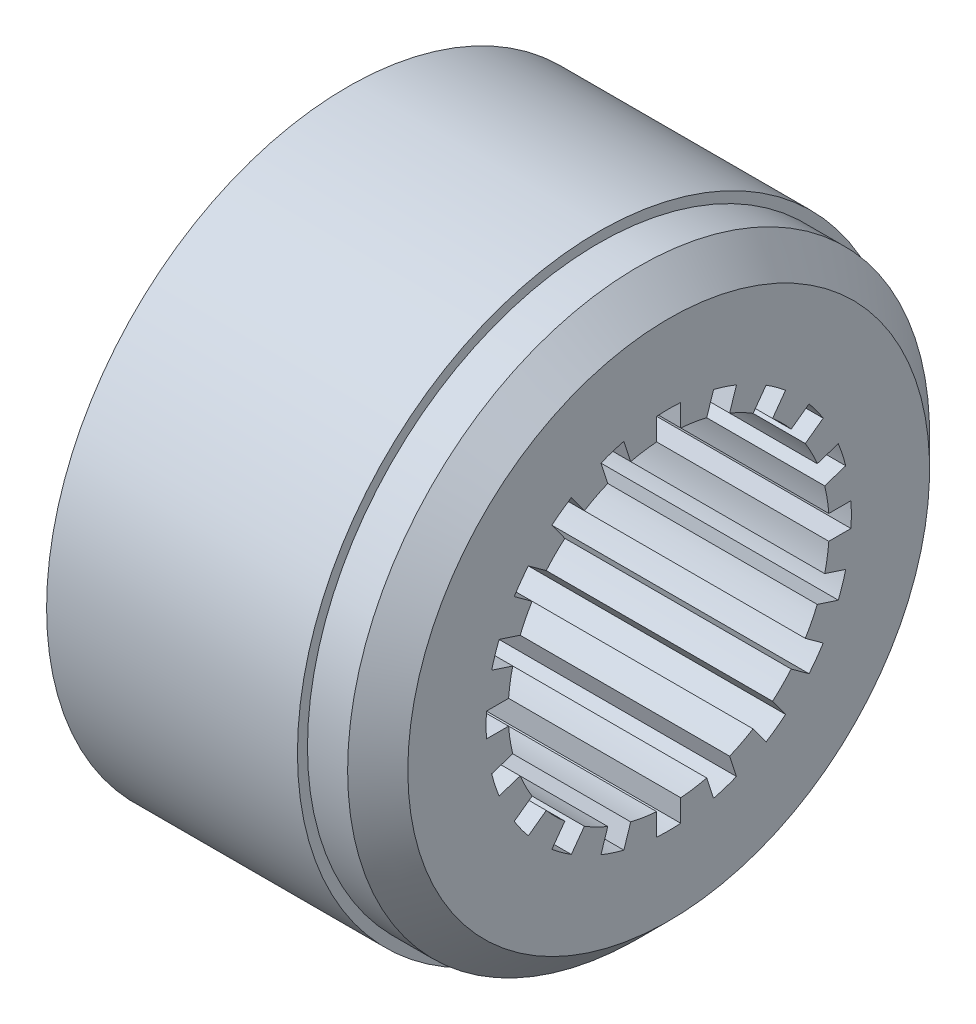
SolidWorks part; units mm, degrees
ref_plane "Face" through (0, 0, 0) normal (0, 0, 1) x (1, 0, 0)
ref_plane "Dessus" through (0, 0, 0) normal (0, 1, 0) x (1, 0, 0)
ref_plane "Droite" through (0, 0, 0) normal (1, 0, 0) x (0, 0, -1)
sketch "Esquisse1" plane through (0, 0, 0) normal (0, 0, 1) x (1, 0, 0)
  line L0 (0, 0) -> (57.3323, 0) construction
  line L1 (3.5, 40) -> (83.5, 40)
  line L2 (83.5, 40) -> (83.5, 65)
  line L3 (76, 72.5) -> (66, 72.5)
  line L4 (66, 72.5) -> (66, 75)
  line L5 (66, 75) -> (3.5, 75)
  line L6 (3.5, 75) -> (3.5, 40)
  line L7 (83.5, 65) -> (76, 72.5)
  point P6 (83.5, 72.5)
  dimension "D1" = 80
  dimension "D2" = 150
  dimension "D3" = 145
  dimension "D4" = 80
  dimension "D5" = 17.5
  dimension "D6" = 7.5
  dimension "D7" = 45
revolve "Révolution1" add sketch "Esquisse1" angle 360 about L0
sketch "Esquisse2" plane through (3.5, 0, 0) normal (-1, 0, 0) x (0, 0, 1)
  line L0 (0, 0) -> (0, 128.4384) construction
hole_wizard "Diamètre du perçage Ø16.5 (16.5)1" positions "Esquisse4" profile "Esquisse3" hole size "Ø16.5" standard "ISO"
sketch "Esquisse4" plane through (3.5, 0, 0) normal (-1, 0, 0) x (0, 0, 1)
  line L0 (0, 0) -> (0, 128.4384) construction
  circle A0 centre (0, 0) radius 40 construction
  point P0 (0, 62.5)
  dimension "D1" = 62.5
sketch "Esquisse3" plane through (3.5, 62.5, 0) normal (0, 1, 0) x (0, 0, 1)
  line L0 (0, 0) -> (0, 18.9571)
  line L1 (0, 18.9571) -> (8.25, 14)
  line L2 (8.25, 14) -> (8.25, 0)
  line L5 (8.25, 0) -> (0, 0)
  line L10 (0, 18.9571) -> (-8.25, 14) construction
  line L11 (0, -6.35) -> (0, 107.95) construction
  dimension "Diamètre du perçage" = 16.5
  dimension "Profondeur du perçage" = 14
  dimension "Angle de pointe" = 118
sketch "Esquisse5" plane through (3.5, 0, 0) normal (-1, 0, 0) x (0, 0, 1)
  line L0 (0, 0) -> (0, 128.4384) construction
  line L1 (11.1765, 44.106) -> (8.334, 35.3577)
  line L2 (-3, 45.401) -> (-3, 36.2026)
  line L3 (-3, 36.2026) -> (3, 36.2026)
  line L4 (3, 45.401) -> (3, 36.2026)
  line L5 (8.334, 35.3577) -> (14.0404, 33.5036)
  line L6 (16.8828, 42.2519) -> (14.0404, 33.5036)
  line L7 (24.259, 38.4935) -> (18.8523, 31.0518)
  line L8 (18.8523, 31.0518) -> (23.7064, 27.5251)
  line L9 (29.1131, 34.9668) -> (23.7064, 27.5251)
  line L10 (34.9668, 29.1131) -> (27.5251, 23.7064)
  line L11 (27.5251, 23.7064) -> (31.0518, 18.8523)
  line L12 (38.4935, 24.259) -> (31.0518, 18.8523)
  line L13 (42.2519, 16.8828) -> (33.5036, 14.0404)
  line L14 (33.5036, 14.0404) -> (35.3577, 8.334)
  line L15 (44.106, 11.1765) -> (35.3577, 8.334)
  line L16 (45.401, 3) -> (36.2026, 3)
  line L17 (36.2026, 3) -> (36.2026, -3)
  line L18 (45.401, -3) -> (36.2026, -3)
  line L19 (44.106, -11.1765) -> (35.3577, -8.334)
  line L20 (35.3577, -8.334) -> (33.5036, -14.0404)
  line L21 (42.2519, -16.8828) -> (33.5036, -14.0404)
  line L22 (38.4935, -24.259) -> (31.0518, -18.8523)
  line L23 (31.0518, -18.8523) -> (27.5251, -23.7064)
  line L24 (34.9668, -29.1131) -> (27.5251, -23.7064)
  line L25 (29.1131, -34.9668) -> (23.7064, -27.5251)
  line L26 (23.7064, -27.5251) -> (18.8523, -31.0518)
  line L27 (24.259, -38.4935) -> (18.8523, -31.0518)
  line L28 (16.8828, -42.2519) -> (14.0404, -33.5036)
  line L29 (14.0404, -33.5036) -> (8.334, -35.3577)
  line L30 (11.1765, -44.106) -> (8.334, -35.3577)
  line L31 (3, -45.401) -> (3, -36.2026)
  line L32 (3, -36.2026) -> (-3, -36.2026)
  line L33 (-3, -45.401) -> (-3, -36.2026)
  line L34 (-11.1765, -44.106) -> (-8.334, -35.3577)
  line L35 (-8.334, -35.3577) -> (-14.0404, -33.5036)
  line L36 (-16.8828, -42.2519) -> (-14.0404, -33.5036)
  line L37 (-24.259, -38.4935) -> (-18.8523, -31.0518)
  line L38 (-18.8523, -31.0518) -> (-23.7064, -27.5251)
  line L39 (-29.1131, -34.9668) -> (-23.7064, -27.5251)
  line L40 (-34.9668, -29.1131) -> (-27.5251, -23.7064)
  line L41 (-27.5251, -23.7064) -> (-31.0518, -18.8523)
  line L42 (-38.4935, -24.259) -> (-31.0518, -18.8523)
  line L43 (-42.2519, -16.8828) -> (-33.5036, -14.0404)
  line L44 (-33.5036, -14.0404) -> (-35.3577, -8.334)
  line L45 (-44.106, -11.1765) -> (-35.3577, -8.334)
  line L46 (-45.401, -3) -> (-36.2026, -3)
  line L47 (-36.2026, -3) -> (-36.2026, 3)
  line L48 (-45.401, 3) -> (-36.2026, 3)
  line L49 (-44.106, 11.1765) -> (-35.3577, 8.334)
  line L50 (-35.3577, 8.334) -> (-33.5036, 14.0404)
  line L51 (-42.2519, 16.8828) -> (-33.5036, 14.0404)
  line L52 (-38.4935, 24.259) -> (-31.0518, 18.8523)
  line L53 (-31.0518, 18.8523) -> (-27.5251, 23.7064)
  line L54 (-34.9668, 29.1131) -> (-27.5251, 23.7064)
  line L55 (-29.1131, 34.9668) -> (-23.7064, 27.5251)
  line L56 (-23.7064, 27.5251) -> (-18.8523, 31.0518)
  line L57 (-24.259, 38.4935) -> (-18.8523, 31.0518)
  line L58 (-16.8828, 42.2519) -> (-14.0404, 33.5036)
  line L59 (-14.0404, 33.5036) -> (-8.334, 35.3577)
  line L60 (-11.1765, 44.106) -> (-8.334, 35.3577)
  arc A0 (3, 45.401) -> (-3, 45.401) centre (0, 0) ccw
  arc A1 (16.8828, 42.2519) -> (11.1765, 44.106) centre (0, 0) ccw
  arc A2 (29.1131, 34.9668) -> (24.259, 38.4935) centre (0, 0) ccw
  arc A3 (38.4935, 24.259) -> (34.9668, 29.1131) centre (0, 0) ccw
  arc A4 (44.106, 11.1765) -> (42.2519, 16.8828) centre (0, 0) ccw
  arc A5 (45.401, -3) -> (45.401, 3) centre (0, 0) ccw
  arc A6 (42.2519, -16.8828) -> (44.106, -11.1765) centre (0, 0) ccw
  arc A7 (34.9668, -29.1131) -> (38.4935, -24.259) centre (0, 0) ccw
  arc A8 (24.259, -38.4935) -> (29.1131, -34.9668) centre (0, 0) ccw
  arc A9 (11.1765, -44.106) -> (16.8828, -42.2519) centre (0, 0) ccw
  arc A10 (-3, -45.401) -> (3, -45.401) centre (0, 0) ccw
  arc A11 (-16.8828, -42.2519) -> (-11.1765, -44.106) centre (0, 0) ccw
  arc A12 (-29.1131, -34.9668) -> (-24.259, -38.4935) centre (0, 0) ccw
  arc A13 (-38.4935, -24.259) -> (-34.9668, -29.1131) centre (0, 0) ccw
  arc A14 (-44.106, -11.1765) -> (-42.2519, -16.8828) centre (0, 0) ccw
  arc A15 (-45.401, 3) -> (-45.401, -3) centre (0, 0) ccw
  arc A16 (-42.2519, 16.8828) -> (-44.106, 11.1765) centre (0, 0) ccw
  arc A17 (-34.9668, 29.1131) -> (-38.4935, 24.259) centre (0, 0) ccw
  arc A18 (-24.259, 38.4935) -> (-29.1131, 34.9668) centre (0, 0) ccw
  arc A19 (-11.1765, 44.106) -> (-16.8828, 42.2519) centre (0, 0) ccw
  dimension "D1" = 91
  dimension "D2" = 3
  dimension "D3" = 3
extrude "Enlèv. mat.-Extru.1" cut sketch "Esquisse5" against normal through all
pattern_circular "Répétition circulaire1" count 3 every 120 about axis through (0, 0, 0) along (1, 0, 0) of "Diamètre du perçage Ø16.5 (16.5)1"
